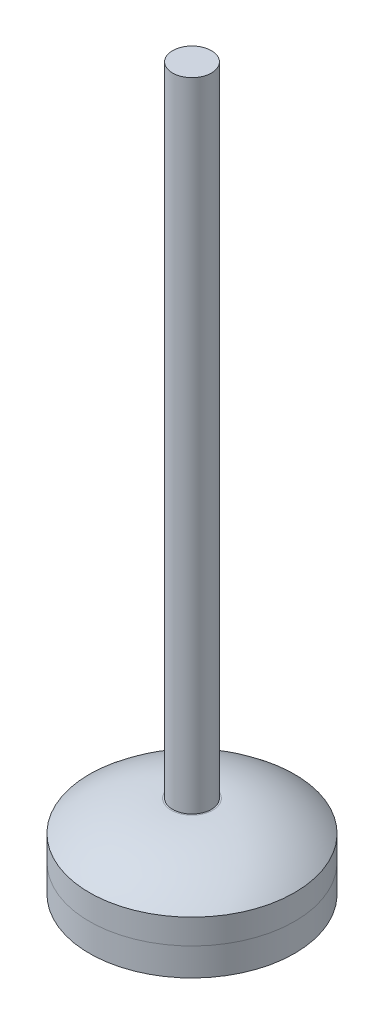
SolidWorks part; units mm, degrees
ref_plane "Plan de face" through (0, 0, 0) normal (0, 0, 1) x (1, 0, 0)
ref_plane "Plan de dessus" through (0, 0, 0) normal (0, 1, 0) x (1, 0, 0)
ref_plane "Plan de droite" through (0, 0, 0) normal (1, 0, 0) x (0, 0, -1)
sketch "Esquisse1" plane through (0, 0, 0) normal (0, 0, 1) x (1, 0, 0)
  line L0 (0, 0) -> (37, 0)
  line L1 (37, 0) -> (37, 9)
  line L3 (7.5, 20) -> (0, 20)
  line L4 (0, 20) -> (0, 0)
  arc A0 (7.5, 20) -> (37, 9) centre (7.5, -25.0568) cw
  dimension "D1" = 9
  dimension "D2" = 20
  dimension "D3" = 37
  dimension "D4" = 7.5
revolve "Révolution1" add sketch "Esquisse1" angle 360 about L4
sketch "Esquisse2" plane through (0, 20, 0) normal (0, 1, 0) x (-1, 0, 0)
  circle A0 centre (0, 0) radius 7
  dimension "D1" = 14
extrude "Extrusion1" add sketch "Esquisse2" along normal blind 230
sketch "Esquisse3" plane through (0, 0, 0) normal (0, -1, 0) x (1, 0, 0)
  circle A0 centre (0, 0) radius 37
  dimension "D1" = 74
extrude "Extrusion2" add sketch "Esquisse3" along normal blind 10 separate body
